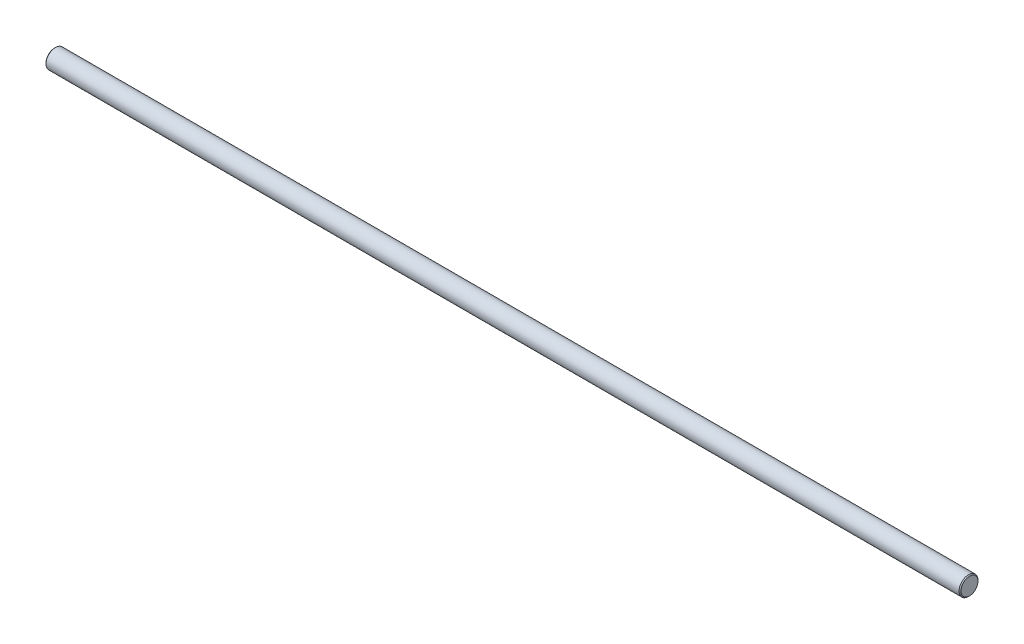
SolidWorks part; units mm, degrees
ref_plane "Front Plane" through (0, 0, 0) normal (0, 0, 1) x (1, 0, 0)
ref_plane "Top Plane" through (0, 0, 0) normal (0, 1, 0) x (1, 0, 0)
ref_plane "Right Plane" through (0, 0, 0) normal (1, 0, 0) x (0, 0, -1)
ref_plane "Plane1" through (0, 0, 0) normal (0, 0, 1) x (1, 0, 0)
sketch "Sketch1" plane through (0, 0, 0) normal (0, 0, 1) x (1, 0, 0)
  line L0 (0, 0) -> (0, 4.5)
  line L1 (0, 4.5) -> (0.5, 5)
  line L2 (0.5, 5) -> (482.5, 5)
  line L3 (482.5, 5) -> (483, 4.5)
  line L4 (483, 4.5) -> (483, 0)
  line L5 (483, 0) -> (0, 0)
  line L6 (483, 0) -> (0, 0) construction
  dimension "D1" = 483
  dimension "D2" = 135
  dimension "D3" = 135
  dimension "D4" = 5
  dimension "D5" = 0.5
  dimension "D6" = 0.5
revolve "Revolve1" add sketch "Sketch1" angle 360 about L6
ref_plane "Plane3" through (254, 0, 0) normal (1, 0, 0) x (0, 0, -1)
ref_plane "Plane4" through (229, 0, 0) normal (-1, 0, 0) x (0, 0, 1)
